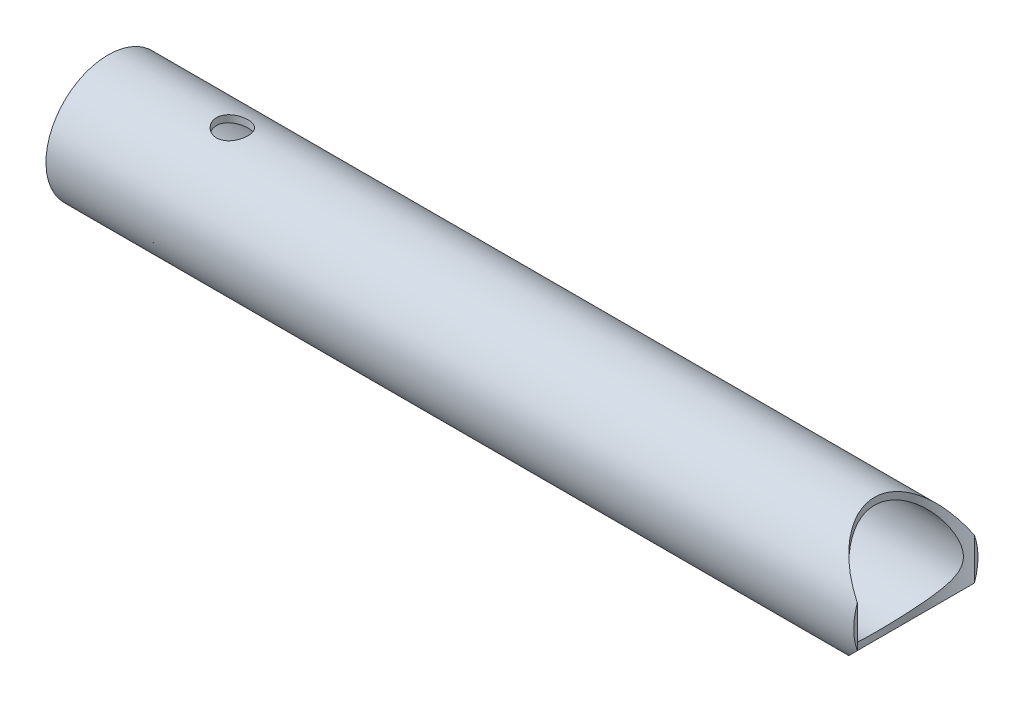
SolidWorks part; units mm, degrees
ref_plane "Front Plane" through (0, 0, 0) normal (0, 0, 1) x (1, 0, 0)
ref_plane "Top Plane" through (0, 0, 0) normal (0, 1, 0) x (1, 0, 0)
ref_plane "Right Plane" through (0, 0, 0) normal (1, 0, 0) x (0, 0, -1)
sketch "Sketch1" plane through (0, 0, 0) normal (1, 0, 0) x (0, 0, -1)
  circle A0 centre (0, 0) radius 19.05
  circle A1 centre (0, 0) radius 16.9418
  dimension "D1" = 38.1
  dimension "D2" = 2.1082
extrude "Extrude1" add sketch "Sketch1" along normal mid plane 247.65
sketch "Sketch2" plane through (0, 0, 0) normal (0, 1, 0) x (1, 0, 0)
  line L4 (123.825, -19.05) -> (123.825, 19.05) construction
  line L5 (123.825, -16.9418) -> (123.825, 16.9418) construction
  line L6 (-123.825, -19.05) -> (123.825, -19.05) construction
  line L7 (123.825, 19.05) -> (-123.825, 19.05) construction
  line L8 (-156.4558, 0) -> (174.0723, 0) construction
  line L11 (123.825, -19.05) -> (123.825, 19.05)
  line L12 (123.825, -16.9418) -> (123.825, 16.9418)
  line L13 (-123.825, -19.05) -> (123.825, -19.05)
  line L14 (123.825, 19.05) -> (-123.825, 19.05)
  circle A0 centre (130.175, 0) radius 19.05
  dimension "D1" = 38.1
extrude "Extrude3" cut sketch "Sketch2" against normal through all and the other way through all
sketch "Sketch3" plane through (0, 0, 0) normal (0, 1, 0) x (1, 0, 0)
  line L0 (-209.524, 0) -> (178.669, 0) construction
  line L2 (-123.825, 19.05) -> (-123.825, -19.05) construction
  circle A0 centre (-85.725, 0) radius 4.826
  dimension "D2" = 9.652
  dimension "D1" = 38.1
extrude "Extrude4" cut sketch "Sketch3" against normal through all and the other way through all
